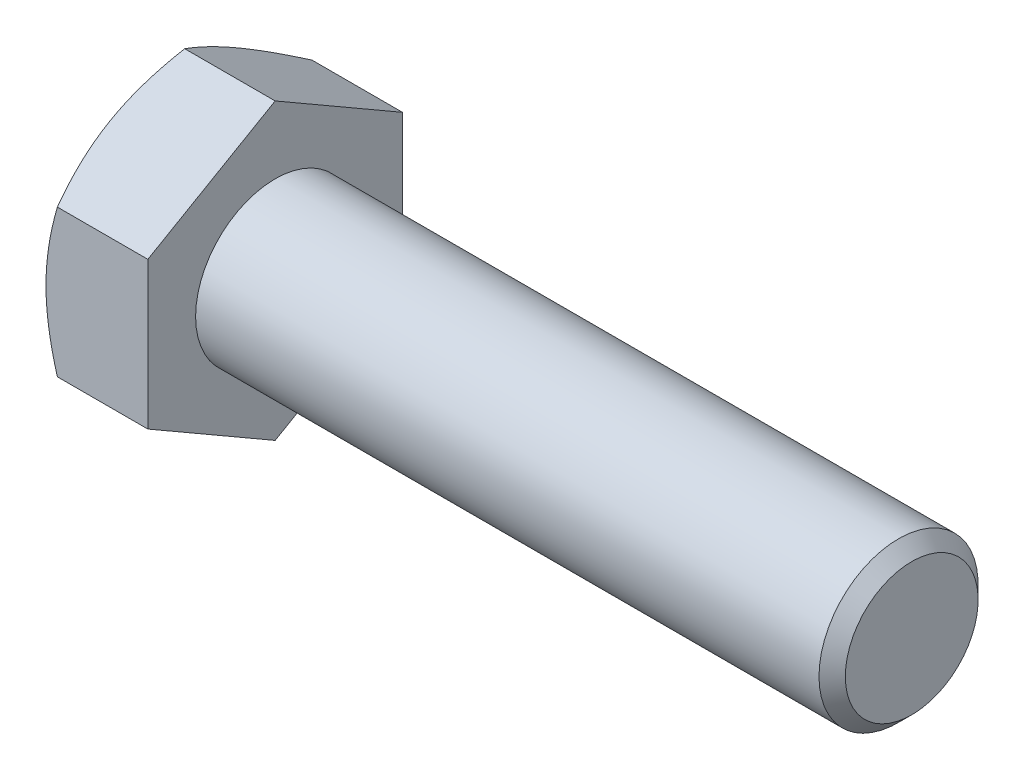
SolidWorks part; units mm, degrees
extrude "BaseHead" add sketch "Sketch1" along normal blind 6.4
sketch "Sketch1" plane through (0, 0, 0) normal (1, 0, 0) x (0, 0, -1)
  line L0 (8, 4.6188) -> (8, -4.6188)
  line L1 (-8, 4.6188) -> (-8, -4.6188)
  line L2 (8, -4.6188) -> (0, -9.2376)
  line L3 (0, -9.2376) -> (-8, -4.6188)
  line L4 (8, 4.6188) -> (0, 9.2376)
  line L5 (0, 9.2376) -> (-8, 4.6188)
ref_plane "Plane1" through (0, 0, 0) normal (0, 0, 1) x (1, 0, 0)
ref_plane "Plane2" through (0, 0, 0) normal (0, 1, 0) x (1, 0, 0)
ref_plane "Plane3" through (0, 0, 0) normal (1, 0, 0) x (0, 0, -1)
sketch "BodySke" plane through (0, 0, 0) normal (0, 0, 1) x (1, 0, 0)
  line L1 (0, 0) -> (46.4, 0)
  line L2 (0, 0) -> (0, 5)
  line L4 (46.4, 0) -> (46.4, 4.172)
  line L5 (6.4, 9.2376) -> (6.4, 4.6188) construction
  line L6 (46.4, 4.172) -> (45.572, 5)
  line L7 (0, 0) -> (110.49, 0) construction
  line L8 (46.4, -4.172) -> (45.572, -5) construction
  line L9 (0, 4.6188) -> (0, -4.6188) construction
  line L10 (7.9, 15.24) -> (7.9, -1.27) construction
  line L11 (20.4, 15.24) -> (20.4, -1.27) construction
  line L12 (6.4, 4.6188) -> (6.4, -4.6188) construction
  line L15 (0, 5) -> (45.572, 5)
revolve "BaseBody" add sketch "BodySke" angle 360 about L7
fillet "HeadFillet" [suppressed] radius 0.4
sketch "Sketch3" plane through (0, 0, 0) normal (0, 0, 1) x (1, 0, 0)
  line L0 (0, 8) -> (3.6013, 14.2376)
  line L1 (0, 9.2376) -> (0, 4.6188) construction
  line L2 (3.6013, 14.2376) -> (3.6013, 19.2376)
  line L3 (3.6013, 19.2376) -> (-10, 19.2376)
  line L4 (-10, 19.2376) -> (-10, 8)
  line L5 (-10, 8) -> (0, 8)
  line L6 (0, 0) -> (99.06, 0) construction
  line L7 (6.4, 9.2376) -> (0, 9.2376) construction
revolve "HeadChamfer" cut sketch "Sketch3" angle 360 about L6
sketch "ThdSchSke" plane through (0, 0, 0) normal (0, 0, 1) x (1, 0, 0)
  line L0 (20.4, -4.172) -> (19.8202, -5)
  line L1 (20.4, -4.172) -> (20.9798, -5)
  line L2 (20.9798, -5) -> (20.9798, -6.25)
  line L3 (-3.175, 0) -> (5.1513, 0) construction
  line L5 (20.9798, -6.25) -> (19.8202, -6.25)
  line L6 (19.8202, -6.25) -> (19.8202, -5)
revolve "ThreadSchematic" [suppressed] cut sketch "ThdSchSke" angle 360 about L3
pattern_linear "ThdSchPat" [suppressed]
equation "\"D3@Sketch1\" = \"Width_flats@Sketch1\" / 2"
equation "\"D4@Sketch1\" = \"D3@Sketch1\""
equation "\"D5@Sketch1\" = \"D4@Sketch1\""
equation "\"Thread_minor@ThreadCosmetic\" = \"Minor_dia@BodySke\""
equation "\"D1@Sketch3\" = \"Width_flats@Sketch1\" / 2"
equation "\"Thread_length@ThreadCosmetic\" = ((sgn( (\"Length@BodySke\" - \"Advance@BodySke\" ) - \"Thread_nom@BodySke\" )-1)*( (\"Length@BodySke\" - \"Advance@BodySke\" ) - \"Thread_nom@BodySke\" ))/-2+ \"Thread_nom@BodySke\""
equation "\"Thread_minor@ThdSchSke\" = \"Minor_dia@BodySke\""
equation "\"Diameter@ThdSchSke\" = \"Diameter@BodySke\""
equation "\"Overcut@ThdSchSke\" = \"Diameter@BodySke\" * 1.25"
equation "\"Start@ThdSchSke\" = \"Head_ht@BaseHead\" + \"Length@BodySke\" - \"Thread_length@ThreadCosmetic\"  '---Non-countersunk---"
equation "\"Num_threads@ThdSchPat\" = int( \"Thread_length@ThreadCosmetic\" / \"Advance@BodySke\" + 0.999 )  + 1"
equation "\"Advance@ThdSchPat\" = \"Thread_length@ThreadCosmetic\" /  (\"Num_threads@ThdSchPat\" - 1) 'relax it"
equation "\"Num_threads@ThdSchPat\" = \"Num_threads@ThdSchPat\" - sgn( \"Num_threads@ThdSchPat\" - 1) '---chamfered tips only---"
